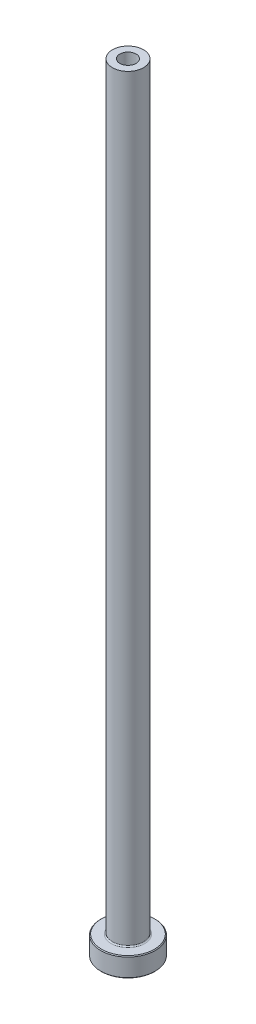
SolidWorks part; units mm, degrees
ref_plane "Front Plane" through (0, 0, 0) normal (0, 0, 1) x (1, 0, 0)
ref_plane "Top Plane" through (0, 0, 0) normal (0, 1, 0) x (1, 0, 0)
ref_plane "Right Plane" through (0, 0, 0) normal (1, 0, 0) x (0, 0, -1)
sketch "Sketch1" plane through (0, 0, 0) normal (0, 0, 1) x (1, 0, 0)
  line L0 (-2.1, 200) -> (-4, 200)
  line L1 (-4, 200) -> (-4, 5)
  line L2 (-4, 5) -> (-7, 5)
  line L3 (-7, 5) -> (-7, 0)
  line L4 (7.7, 0) -> (-7.7, 0) construction
  line L5 (-7, 0) -> (-2.35, 0)
  line L6 (-2.1, 155) -> (-2.1, 200)
  line L7 (0, 92.1877) -> (0, -15.5353) construction
  line L8 (0, -7.7) -> (0, 7.7) construction
  line L9 (-2.1, 155) -> (-2.35, 143)
  line L10 (-2.35, 143) -> (-2.35, 0)
  dimension "D1" = 0.25
  dimension "ID" = 4.2
  dimension "OD" = 8
  dimension "L" = 200
  dimension "H" = 14
  dimension "T" = 5
  dimension "N" = 45
  dimension "D2" = 12
revolve "Revolve1" add sketch "Sketch1" angle 360 about L7
fillet "Fillet1" radius 0.3 1 edges at (0, 5, 4)
chamfer "Chamfer1" distance 0.2 angle 45 2 edges at (0, 5, 7) (0, 0, 7)
chamfer "Chamfer3" distance 0.5 angle 45 1 edges at (0, 0, 2.35)
